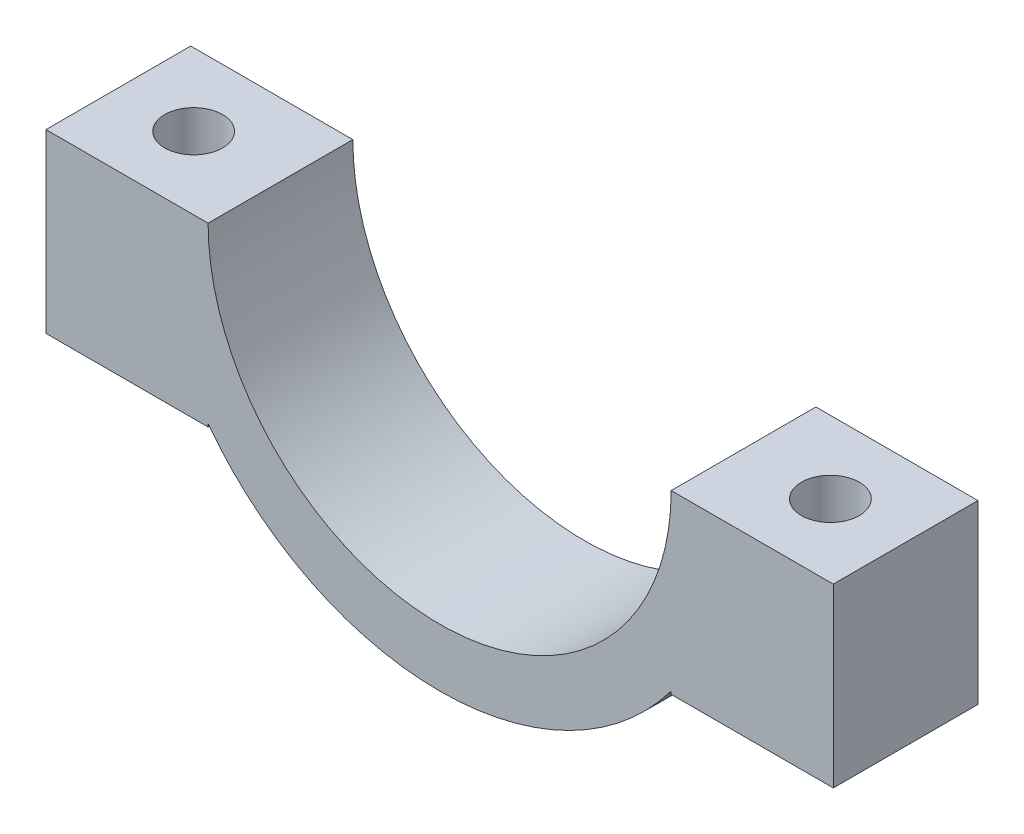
SolidWorks part; units mm, degrees
ref_plane "Front Plane" through (0, 0, 0) normal (0, 0, 1) x (1, 0, 0)
ref_plane "Top Plane" through (0, 0, 0) normal (0, 1, 0) x (1, 0, 0)
ref_plane "Right Plane" through (0, 0, 0) normal (1, 0, 0) x (0, 0, -1)
sketch "Sketch2" plane through (0, 0, 0) normal (0, 0, 1) x (1, 0, 0)
  line L0 (-1000, 0) -> (49000, 0) construction
  line L1 (-8, 0) -> (-13.6, 0)
  line L2 (-13.6, 0) -> (-13.6, 10)
  line L3 (-13.6, 10) -> (-8, 10)
  line L4 (-8, 10) -> (-8, 0)
  line L5 (0, -1000) -> (0, 49000) construction
  line L6 (8, 0) -> (13.6, 0)
  line L7 (13.6, 0) -> (13.6, 10)
  line L8 (13.6, 10) -> (8, 10)
  line L9 (8, 10) -> (8, 0)
  line L11 (-13.6, 0) -> (-8, 0)
  line L12 (-13.6, 0) -> (-13.6, -6.1)
  line L13 (-13.6, -6.1) -> (-8, -6.1)
  line L14 (-8, 0) -> (-8, -6.1)
  line L15 (13.6, 0) -> (8, 0)
  line L16 (13.6, 0) -> (13.6, -6.1)
  line L17 (13.6, -6.1) -> (8, -6.1)
  line L18 (8, 0) -> (8, -6.1)
  circle A0 centre (0, 0) radius 8
  circle A1 centre (0, 0) radius 10
  circle A2 centre (-5.5966, 11.6315) radius 2.9079
  circle A3 centre (5.6058, 11.6315) radius 2.9079
  spline S0 degree 1 poles (-8, 10) (0, 10) knots 0 0 1 1
  dimension "D1" = 16
  dimension "D2" = 20
  dimension "D5" = 10
  dimension "D3" = 5.6
  dimension "D4" = 10
  dimension "D6" = 5.6
  dimension "D7" = 6.1
  dimension "D8" = 6.1
extrude "Boss-Extrude1" add sketch "Sketch2" along normal blind 5 contours A1 L11 L12 L13 L14 | L1 A1 L14 | L14 A1 L18 A0 | L18 A1 L6 | A1 L18 L17 L16 L15
sketch "Sketch3" plane through (0, 0, 0) normal (0, 1, 0) x (1, 0, 0)
  line L0 (-43.8792, -2.5) -> (17.8792, -2.5) construction
  line L1 (0, -1000) -> (0, 49000) construction
  line L2 (-11, -1003.1301) -> (-11, 48996.8699) construction
  line L3 (11, -1002.7941) -> (11, 48997.2059) construction
  circle A0 centre (-11, -2.5) radius 1
  circle A1 centre (11, -2.5) radius 1
  point P3 (-13, -2.5)
  dimension "D3" = 2
  dimension "D4" = 2
  dimension "D1" = 11
  dimension "D2" = 11
extrude "Cut-Extrude1" cut sketch "Sketch3" against normal blind 10
